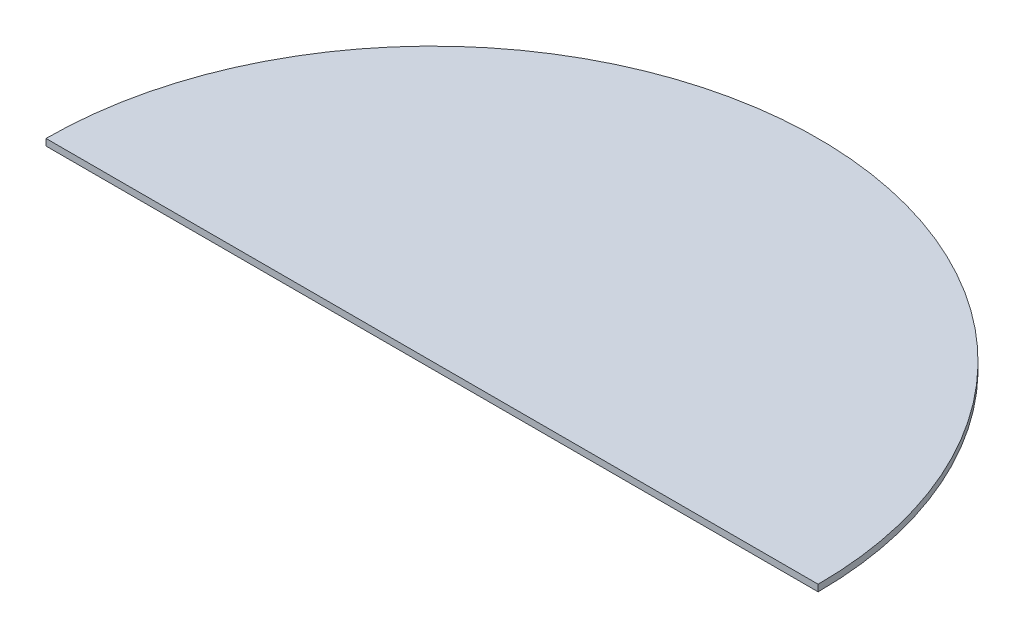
SolidWorks part; units mm, degrees
ref_plane "Front Plane" through (0, 0, 0) normal (0, 0, 1) x (1, 0, 0)
ref_plane "Top Plane" through (0, 0, 0) normal (0, 1, 0) x (1, 0, 0)
ref_plane "Right Plane" through (0, 0, 0) normal (1, 0, 0) x (0, 0, -1)
sketch "Sketch1" plane through (0, 0, 0) normal (0, 1, 0) x (1, 0, 0)
  line L0 (0, 0) -> (140, 0)
  arc A0 (140, 0) -> (0, 0) centre (70, 0) ccw
  dimension "D1" = 70
extrude "Extrude1" add sketch "Sketch1" along normal blind 1.2
